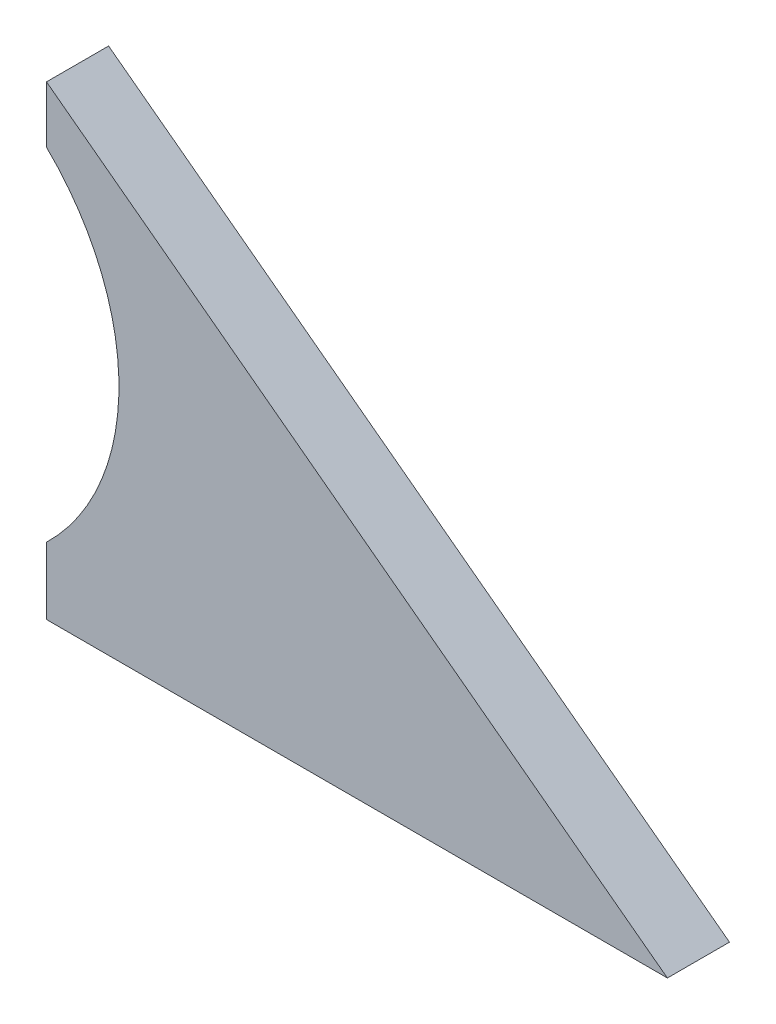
SolidWorks part; units mm, degrees
ref_plane "前视基准面" through (0, 0, 0) normal (0, 0, 1) x (1, 0, 0)
ref_plane "上视基准面" through (0, 0, 0) normal (0, 1, 0) x (1, 0, 0)
ref_plane "右视基准面" through (0, 0, 0) normal (1, 0, 0) x (0, 0, -1)
sketch "草图1" plane through (0, 0, 0) normal (0, 0, 1) x (1, 0, 0)
  line L0 (0, 45) -> (0, 39.5227)
  line L1 (0, 0) -> (60, 0)
  line L2 (60, 0) -> (0, 45)
  line L3 (-38.8135, 23) -> (18.8003, 23) construction
  line L4 (0, 6.4773) -> (0, 0)
  arc A0 (0, 6.4773) -> (0, 39.5227) centre (-16, 23) ccw
  dimension "D4" = 46
  dimension "D5" = 16
  dimension "D1" = 45
  dimension "D2" = 60
  dimension "D3" = 23
extrude "拉伸1" add sketch "草图1" along normal blind 6
